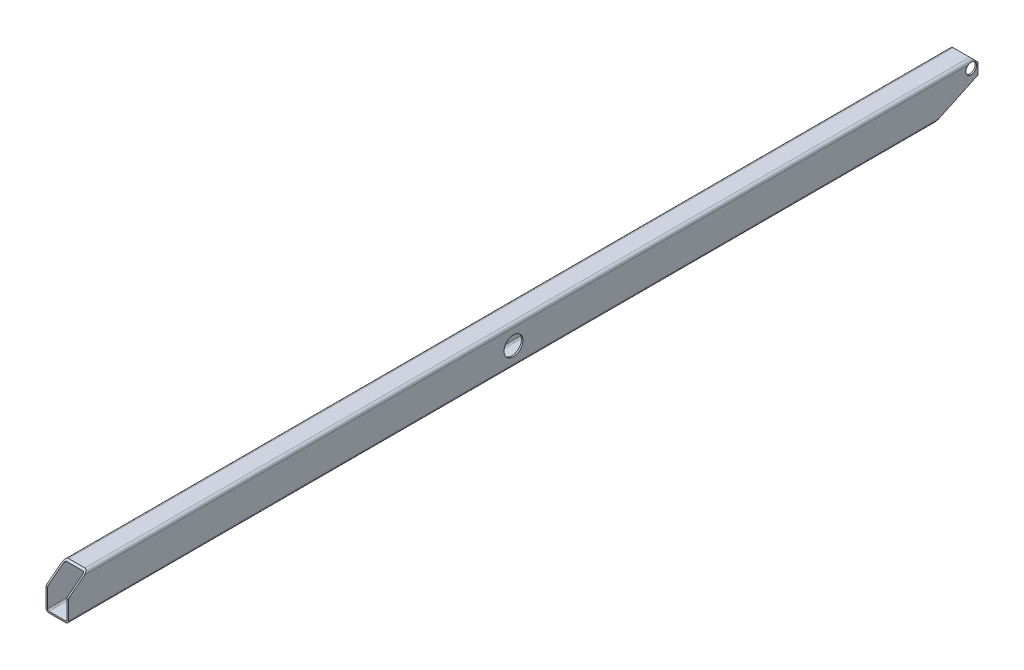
SolidWorks part; units mm, degrees
ref_plane "Plan de face" through (0, 0, 0) normal (0, 0, 1) x (1, 0, 0)
ref_plane "Plan de dessus" through (0, 0, 0) normal (0, 1, 0) x (1, 0, 0)
ref_plane "Plan de droite" through (0, 0, 0) normal (1, 0, 0) x (0, 0, -1)
sketch "Esquisse1" plane through (0, 0, 0) normal (0, 0, 1) x (1, 0, 0)
  line L0 (20, 0) -> (130, 0)
  line L1 (150, 20) -> (150, 230)
  line L2 (130, 250) -> (20, 250)
  line L3 (0, 230) -> (0, 20)
  line L4 (130, 240) -> (20, 240)
  line L5 (10, 230) -> (10, 20)
  line L6 (20, 10) -> (130, 10)
  line L7 (140, 20) -> (140, 230)
  arc A0 (130, 0) -> (150, 20) centre (130, 20) ccw
  arc A1 (150, 230) -> (130, 250) centre (130, 230) ccw
  arc A2 (20, 250) -> (0, 230) centre (20, 230) ccw
  arc A3 (0, 20) -> (20, 0) centre (20, 20) ccw
  arc A4 (20, 240) -> (10, 230) centre (20, 230) ccw
  arc A5 (10, 20) -> (20, 10) centre (20, 20) ccw
  arc A6 (130, 10) -> (140, 20) centre (130, 20) ccw
  arc A7 (140, 230) -> (130, 240) centre (130, 230) ccw
  dimension "D4" = 20
  dimension "D1" = 150
  dimension "D2" = 250
  dimension "D3" = 10
extrude "Extrusion1" add sketch "Esquisse1" along normal mid plane 6058
chamfer "Chanfrein1" distance 35 angle 45 1 edges at (75, 250, -3029)
chamfer "Chanfrein2" distance 130 distance2 100 1 edges at (75, 250, 3029)
sketch "Esquisse2" plane through (150, 0, 0) normal (1, 0, 0) x (0, 0, -1)
  line L0 (3029, 20) -> (3029, 215) construction
  line L1 (-2899, 250) -> (2994, 250) construction
  circle A0 centre (2984, 200) radius 35.5
  dimension "D3" = 71
  dimension "D1" = 45
  dimension "D2" = 50
extrude "Enlèv. mat.-Extru.1" cut sketch "Esquisse2" against normal up to surface (150 mm away)
sketch "Esquisse3" plane through (150, 0, 0) normal (1, 0, 0) x (0, 0, -1)
  line L0 (-2899, 250) -> (2994, 250) construction
  circle A0 centre (-65.0777, 125) radius 63
  arc A1 (2965.0197, 230) -> (3002.9803, 230) centre (2984, 200) ccw construction
  dimension "D2" = 126
  dimension "D3" = 3050
  dimension "D1" = 125
extrude "Enlèv. mat.-Extru.2" cut sketch "Esquisse3" against normal up to surface (150 mm away)
sketch "Esquisse4" plane through (150, 0, 0) normal (1, 0, 0) x (0, 0, -1)
  line L0 (3029, 140) -> (2729, 0)
  line L1 (3029, 20) -> (3029, 215) construction
  line L2 (-3029, 0) -> (3029, 0) construction
  line L3 (2729, 0) -> (3029, 0)
  line L4 (3029, 0) -> (3029, 140)
  dimension "D1" = 140
  dimension "D2" = 300
extrude "Enlèv. mat.-Extru.3" cut sketch "Esquisse4" against normal blind 150
fillet "Congé1" radius 20 2 edges at (5, 150, 3029) (145, 150, 3029)
